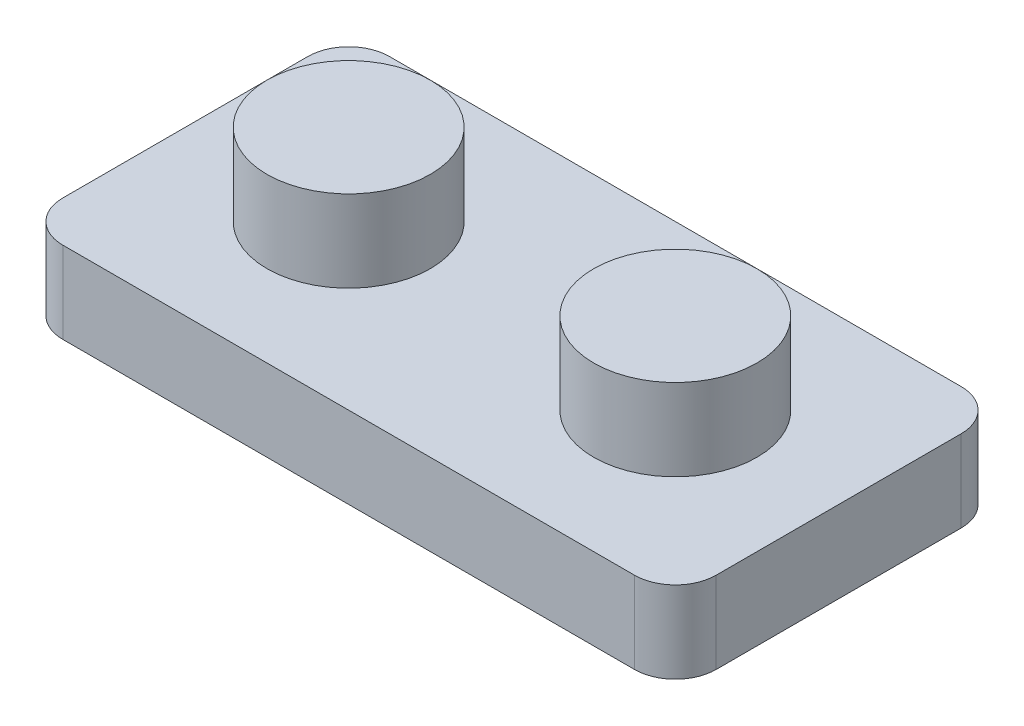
SolidWorks part; units mm, degrees
ref_plane "Front Plane" through (0, 0, 0) normal (0, 0, 1) x (1, 0, 0)
ref_plane "Top Plane" through (0, 0, 0) normal (0, 1, 0) x (1, 0, 0)
ref_plane "Right Plane" through (0, 0, 0) normal (1, 0, 0) x (0, 0, -1)
sketch "Sketch1" plane through (0, 0, 0) normal (0, 1, 0) x (1, 0, 0)
  line L1 (0, 0) -> (101.6, 0)
  line L2 (0, 0) -> (0, 50.8)
  line L3 (0, 50.8) -> (101.6, 50.8)
  line L4 (101.6, 0) -> (101.6, 50.8)
  dimension "D1" = 101.6
  dimension "D2" = 50.8
extrude "Extrude1" add sketch "Sketch1" along normal blind 12.7
sketch "Sketch2" plane through (0, 12.7, 0) normal (0, 1, 0) x (-1, 0, 0)
  line L0 (-50.8, 0) -> (-50.8, -50.8) construction
  line L1 (0, 0) -> (-101.6, 0) construction
  line L2 (-101.6, -50.8) -> (0, -50.8) construction
  line L3 (0, -50.8) -> (0, 0) construction
  circle A0 centre (-25.4, -25.4) radius 12.7
  circle A1 centre (-76.2, -25.4) radius 12.7
  dimension "D1" = 25.4
  dimension "D2" = 25.4
  dimension "D3" = 25.4
extrude "Extrude2" add sketch "Sketch2" along normal blind 12.7
fillet "Fillet1" radius 6.35 4 edges at (101.6, 6.35, 0) (101.6, 6.35, -50.8) (0, 6.35, -50.8) (0, 6.35, 0)
